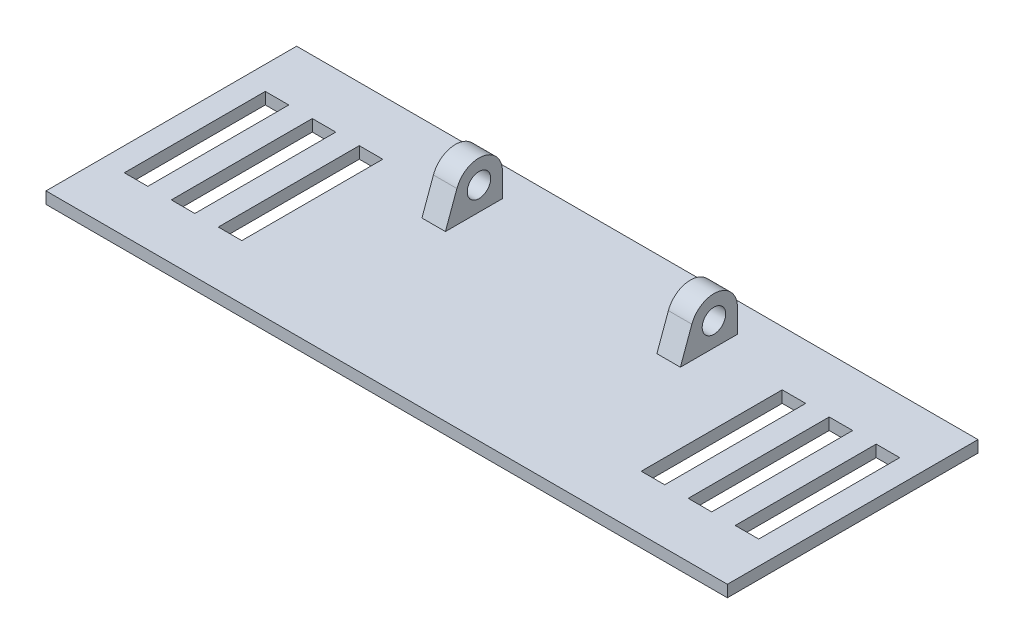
SolidWorks part; units mm, degrees
ref_plane "前视基准面" through (0, 0, 0) normal (0, 0, 1) x (1, 0, 0)
ref_plane "上视基准面" through (0, 0, 0) normal (0, 1, 0) x (1, 0, 0)
ref_plane "右视基准面" through (0, 0, 0) normal (1, 0, 0) x (0, 0, -1)
sketch "草图1" plane through (0, 0, 0) normal (0, 1, 0) x (1, 0, 0)
  line L1 (-45.5, -18) -> (45.5, -18)
  line L2 (-45.5, -18) -> (-45.5, 18)
  line L3 (-45.5, 18) -> (45.5, 18)
  line L4 (45.5, -18) -> (45.5, 18)
  line L5 (-45.5, -18) -> (45.5, 18) construction
  line L6 (-45.5, 18) -> (45.5, -18) construction
  point P0 (0, 0)
  dimension "D1" = 91
  dimension "D2" = 36
extrude "凸台-拉伸1" add sketch "草图1" along normal blind 17
shell "抽壳1" thickness 1.5
fillet "圆角1" radius 2.5 4 edges at (-45.5, 8.5, 18) (-45.5, 8.5, -18) (45.5, 8.5, 18) (45.5, 8.5, -18)
sketch "草图2" plane through (0, 1.5, 0) normal (0, 1, 0) x (1, 0, 0)
  line L1 (-36.25, -11.5) -> (36.25, -11.5)
  line L2 (-36.25, -11.5) -> (-36.25, 11.5)
  line L3 (-36.25, 11.5) -> (36.25, 11.5)
  line L4 (36.25, -11.5) -> (36.25, 11.5)
  line L5 (-36.25, -11.5) -> (36.25, 11.5) construction
  line L6 (-36.25, 11.5) -> (36.25, -11.5) construction
  point P0 (0, 0)
  dimension "D1" = 72.5
  dimension "D2" = 23
extrude "切除-拉伸1" cut sketch "草图2" against normal up to next
sketch "草图3" plane through (0, 1.5, 0) normal (0, 1, 0) x (1, 0, 0)
  line L0 (44, 16.5) -> (-44, 16.5) construction
  line L1 (-44, 16.5) -> (-44, -16.5) construction
  line L2 (-44, 16.5) -> (-41, 16.5)
  line L3 (-44, 16.5) -> (-44, 13.5)
  arc A0 (-44, 13.5) -> (-41, 16.5) centre (-41, 13.5) ccw
  dimension "D1" = 6
extrude "凸台-拉伸2" add sketch "草图3" along normal blind 6.5
mirror "镜向1" about plane through (0, 0, 0) normal (1, 0, 0) of "凸台-拉伸2"
mirror "镜向2" about plane through (0, 0, 0) normal (0, 0, 1) of "镜向1", "凸台-拉伸2"
sketch "草图4" plane through (45.5, 0, 0) normal (1, 0, 0) x (0, 0, -1)
  line L0 (-6.5, 15.5) -> (6.5, 15.5)
  line L1 (-6.5, 15.5) -> (-6.5, 8.5)
  line L2 (6.5, 15.5) -> (6.5, 8.5)
  line L3 (-6.5, 8.5) -> (6.5, 8.5)
  line L7 (-15.5, 17) -> (-15.5, 0) construction
  line L9 (-15.5, 17) -> (15.5, 17) construction
  dimension "D1" = 7
  dimension "D2" = 13
  dimension "D3" = 9
  dimension "D4" = 8.5
extrude "切除-拉伸2" cut sketch "草图4" against normal up to next
sketch "草图5" plane through (0, 17, 0) normal (0, 1, 0) x (1, 0, 0)
  line L0 (44, 16.5) -> (-44, 16.5) construction
  line L1 (-44, 16.5) -> (-44, -16.5) construction
  line L2 (-44, -16.5) -> (44, -16.5) construction
  line L3 (44, -16.5) -> (44, 16.5) construction
  line L4 (44, 16.5) -> (-44, 16.5) construction
  line L5 (-44, 16.5) -> (-44, -16.5) construction
  line L6 (-44, -16.5) -> (44, -16.5) construction
  line L7 (44, -16.5) -> (44, 16.5) construction
  line L8 (43.5, 16) -> (-43.5, 16)
  line L9 (-43.5, 16) -> (-43.5, -16)
  line L10 (-43.5, -16) -> (43.5, -16)
  line L11 (43.5, -16) -> (43.5, 16)
  dimension "D1" = 0.5
extrude "凸台-拉伸3" add sketch "草图5" along normal blind 1.5 separate body
sketch "草图6" plane through (0, 18.5, 0) normal (0, 1, 0) x (1, 0, 0)
  line L0 (-43.5, 16) -> (-43.5, -16) construction
  line L1 (-40.5, 9) -> (-37.5, 9)
  line L2 (-40.5, 9) -> (-40.5, -9)
  line L3 (-40.5, -9) -> (-37.5, -9)
  line L4 (-37.5, 9) -> (-37.5, -9)
  line L5 (-40.5, 9) -> (-37.5, -9) construction
  line L6 (-40.5, -9) -> (-37.5, 9) construction
  line L8 (-1000, 0) -> (49000, 0) construction
  point P0 (-39, 0)
  dimension "D1" = 3
  dimension "D2" = 18
  dimension "D3" = 3
extrude "切除-拉伸3" cut sketch "草图6" against normal blind 1.5
pattern_linear "阵列(线性)1" count 3 spacing 6 along (1, 0, 0) of "切除-拉伸3"
mirror "镜向3" about plane through (0, 0, 0) normal (1, 0, 0) of "阵列(线性)1", "切除-拉伸3"
ref_plane "基准面1" through (15, 0, 0) normal (1, 0, 0) x (0, 0, -1)
ref_plane "基准面2" through (-15, 0, 0) normal (1, 0, 0) x (0, 0, -1)
sketch "草图7" plane through (-15, 0, 0) normal (1, 0, 0) x (0, 0, -1)
  line L0 (6.4647, 22.5261) -> (4.9994, 18.5)
  line L2 (-16, 18.5) -> (16, 18.5) construction
  line L3 (12.2838, 21.5) -> (12.2838, 18.5)
  line L4 (4.9994, 18.5) -> (12.2838, 18.5)
  arc A0 (12.2838, 21.5) -> (6.4647, 22.5261) centre (9.2838, 21.5) ccw
  dimension "D3" = 6
  dimension "D1" = 70
  dimension "D2" = 3
extrude "凸台-拉伸4" add sketch "草图7" along normal mid plane 3
sketch "草图8" plane through (-13.5, 0, 0) normal (1, 0, 0) x (0, 0, -1)
  circle A0 centre (9.2838, 21.5) radius 1.5
  dimension "D1" = 3
extrude "切除-拉伸4" cut sketch "草图8" against normal up to next (3 mm away)
mirror "镜向4" about plane through (0, 0, 0) normal (1, 0, 0) of "切除-拉伸4", "凸台-拉伸4"
sketch "草图9" plane through (0, 17, 0) normal (0, 1, 0) x (1, 0, 0)
  line L0 (43, 18) -> (-43, 18) construction
  line L1 (-45.5, -18) -> (45.5, -18)
  line L2 (-45.5, -18) -> (-45.5, 18)
  line L3 (-45.5, 18) -> (45.5, 18)
  line L4 (45.5, -18) -> (45.5, 18)
  line L5 (-45.5, -18) -> (45.5, 18) construction
  line L6 (-45.5, 18) -> (45.5, -18) construction
  line L7 (45.5, -15.5) -> (45.5, 15.5) construction
  point P0 (0, 0)
extrude "切除-拉伸5" cut sketch "草图9" against normal up to next
